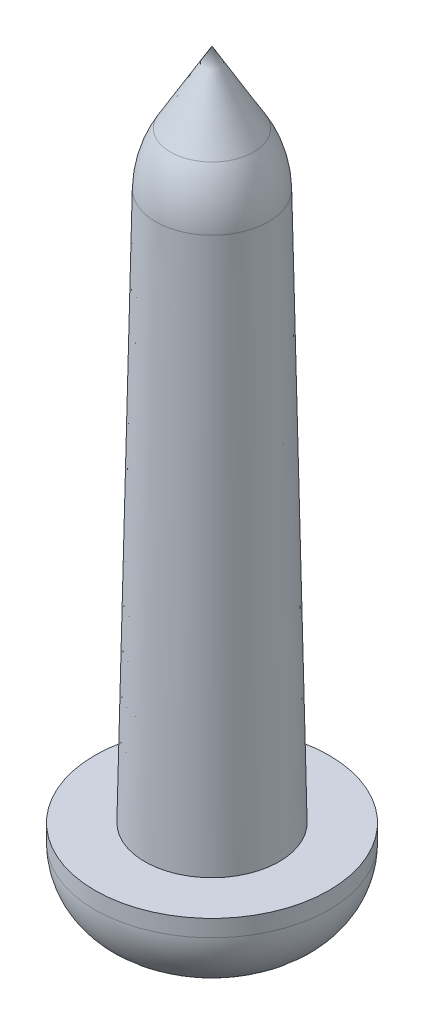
SolidWorks part; units mm, degrees
ref_plane "Face" through (0, 0, 0) normal (0, 0, 1) x (1, 0, 0)
ref_plane "Dessus" through (0, 0, 0) normal (0, 1, 0) x (1, 0, 0)
ref_plane "Droite" through (0, 0, 0) normal (1, 0, 0) x (0, 0, -1)
sketch "Esquisse1" plane through (0, 0, 0) normal (0, 0, 1) x (1, 0, 0)
  line L0 (0, 0) -> (0, 11.25) construction
  line L1 (0, 0) -> (0.74, 0)
  line L2 (1.74, 1) -> (1.74, 1.25)
  line L3 (0, 11.25) -> (0, 0)
  line L4 (0.8379, 9.406) -> (1, 1.25)
  line L5 (1.74, 1.25) -> (1, 1.25)
  line L7 (0.6168, 10.1926) -> (0, 11.25)
  arc A0 (0.74, 0) -> (1.74, 1) centre (0.74, 1) ccw
  arc A1 (0.6168, 10.1926) -> (0.8379, 9.406) centre (-0.7868, 9.3738) cw
  point P11 (1.74, 0)
  dimension "D1" = 1
  dimension "D2" = 1.74
  dimension "D3" = 1
  dimension "D4" = 1.25
  dimension "D5" = 10
revolve "Base-Révolution" add sketch "Esquisse1" angle 360 about L0
sketch "Esquisse2" plane through (0, 0, 0) normal (0, -1, 0) x (1, 0, 0)
  line L0 (0.35, -1.5) -> (0.35, -0.55)
  line L1 (-0.35, -1.5) -> (-0.35, -0.55)
  line L2 (1.5, 0.35) -> (0.55, 0.35)
  line L3 (1.5, -0.35) -> (0.55, -0.35)
  line L4 (1.5, 0.35) -> (1.5, -0.35)
  line L5 (0.35, -1.5) -> (-0.35, -1.5)
  line L6 (-1.5, -0.35) -> (-0.55, -0.35)
  line L7 (-1.5, 0.35) -> (-0.55, 0.35)
  line L8 (-1.5, -0.35) -> (-1.5, 0.35)
  line L9 (-0.35, 1.5) -> (-0.35, 0.55)
  line L10 (0.35, 1.5) -> (0.35, 0.55)
  line L11 (-0.35, 1.5) -> (0.35, 1.5)
  line L12 (0, 0) -> (-1.5, 0) construction
  line L13 (0, 0) -> (1.5, 0) construction
  arc A0 (-0.55, 0.35) -> (-0.35, 0.55) centre (-0.55, 0.55) ccw
  arc A1 (0.55, 0.35) -> (0.35, 0.55) centre (0.55, 0.55) cw
  arc A2 (0.55, -0.35) -> (0.35, -0.55) centre (0.55, -0.55) ccw
  arc A3 (-0.35, -0.55) -> (-0.55, -0.35) centre (-0.55, -0.55) ccw
  dimension "D1" = 0.2
  dimension "D2" = 0.7
  dimension "D3" = 3
extrude "Enlèv. mat.-Extru.1" cut sketch "Esquisse2" against normal blind 1 draft 12
